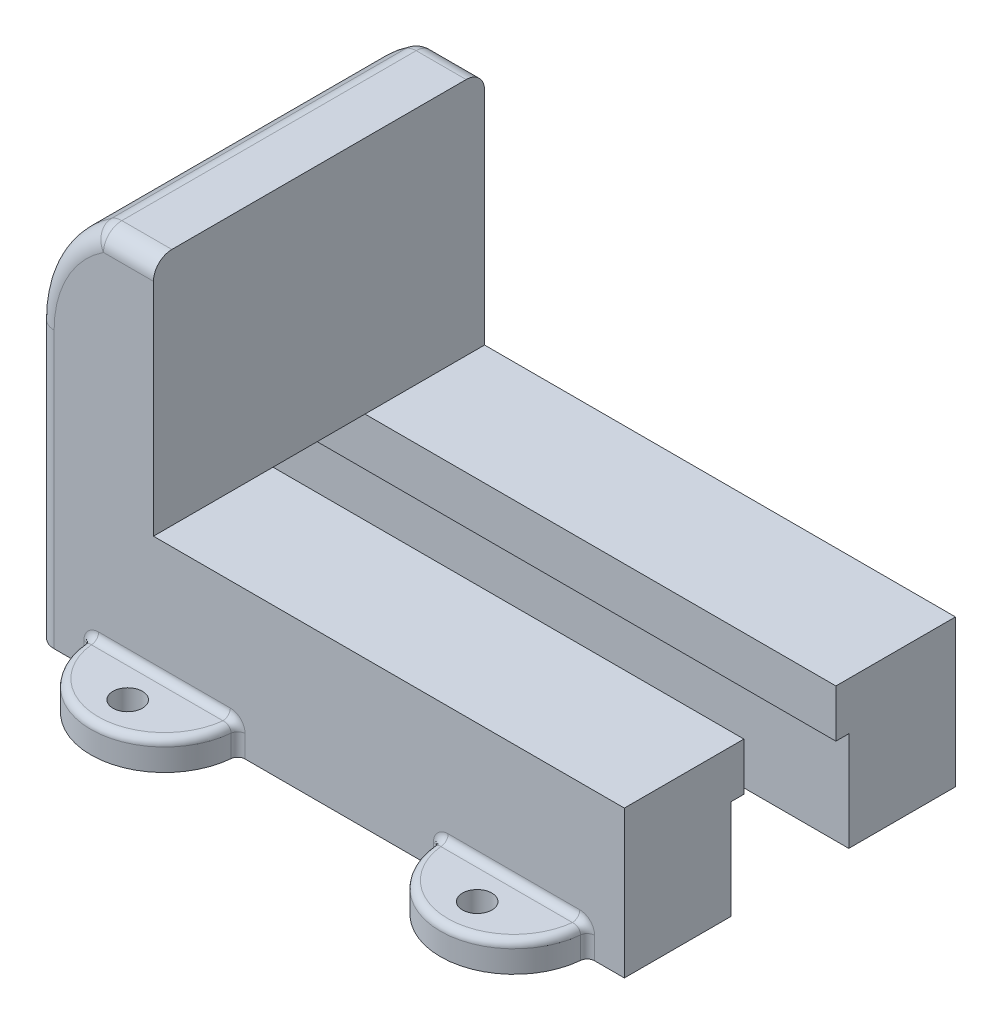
SolidWorks part; units mm, degrees
ref_plane "Front Plane" through (0, 0, 0) normal (0, 0, 1) x (1, 0, 0)
ref_plane "Top Plane" through (0, 0, 0) normal (0, 1, 0) x (1, 0, 0)
ref_plane "Right Plane" through (0, 0, 0) normal (1, 0, 0) x (0, 0, -1)
sketch "Sketch1" plane through (0, 0, 0) normal (0, 0, 1) x (1, 0, 0)
  line L1 (0, 0) -> (185, 0)
  line L2 (0, 0) -> (0, 40)
  line L3 (0, 40) -> (185, 40)
  line L4 (185, 0) -> (185, 40)
  dimension "D1" = 40
  dimension "D2" = 185
extrude "Extrude1" add sketch "Sketch1" along normal mid plane 90
sketch "Sketch2" plane through (0, 0, 45) normal (0, 0, 1) x (1, 0, 0)
  line L1 (0, 40) -> (32, 40)
  line L2 (0, 40) -> (0, 75)
  line L3 (16.9722, 105) -> (32, 105)
  line L4 (32, 40) -> (32, 105)
  arc A0 (0, 75) -> (16.9722, 105) centre (35, 75) cw
  dimension "D2" = 35
  dimension "D1" = 32
  dimension "D3" = 65
  dimension "D4" = 30
extrude "Extrude2" add sketch "Sketch2" against normal up to vertex (90 mm away)
sketch "Sketch3" plane through (185, 0, 0) normal (1, 0, 0) x (0, 0, -1)
  line L0 (-45, 0) -> (-45, 40) construction
  line L1 (-45, 40) -> (45, 40)
  line L2 (-45, 40) -> (-45, 55)
  line L3 (-45, 55) -> (-17, 55)
  line L4 (45, 40) -> (45, 55)
  line L5 (-45, 40) -> (45, 40) construction
  line L6 (-45, 0) -> (45, 0) construction
  line L7 (17, 55) -> (45, 55)
  line L8 (0, 50) -> (0, -50) construction
  arc A0 (17, 55) -> (-17, 55) centre (0, 55) ccw
  dimension "D2" = 17
  dimension "D1" = 55
extrude "Extrude3" add sketch "Sketch3" against normal blind 25
sketch "Sketch4" plane through (185, 0, 0) normal (1, 0, 0) x (0, 0, -1)
  line L0 (-45, 0) -> (45, 0) construction
  line L1 (-16, 0) -> (16, 0)
  line L2 (-12.5, 27) -> (-12.5, 40)
  line L3 (-12.5, 40) -> (12.5, 40)
  line L4 (12.5, 27) -> (12.5, 40)
  line L5 (-16, 0) -> (-16, 27)
  line L6 (-16, 27) -> (-12.5, 27)
  line L7 (16, 27) -> (16, 0)
  line L8 (0, 0) -> (0, 40) construction
  line L9 (12.5, 27) -> (16, 27)
  dimension "D1" = 40
  dimension "D2" = 25
  dimension "D3" = 32
  dimension "D4" = 27
extrude "Cut-Extrude1" cut sketch "Sketch4" against normal through all
sketch "Sketch5" plane through (0, 0, 0) normal (0, -1, 0) x (1, 0, 0)
  line L0 (0, 45) -> (185, 45) construction
  line L1 (15, 45) -> (55, 45)
  arc A0 (15, 45) -> (55, 45) centre (35, 45) cw
  dimension "D1" = 20
  dimension "D2" = 35
extrude "Extrude4" add sketch "Sketch5" against normal blind 8
sketch "Sketch6" plane through (0, 0, 0) normal (0, -1, 0) x (1, 0, 0)
  line L0 (55, 45) -> (185, 45) construction
  line L1 (110, 45) -> (150, 45)
  line L3 (185, 45) -> (185, 16) construction
  arc A0 (110, 45) -> (150, 45) centre (130, 45) cw
  dimension "D1" = 20
  dimension "D2" = 55
extrude "Extrude5" add sketch "Sketch6" against normal up to surface (8 mm away)
mirror "Mirror1" about plane through (0, 0, 0) normal (0, 0, 1) of "Extrude5", "Extrude4"
hole_wizard "Ø8.0 (8) Diameter Hole1" positions "Sketch11" profile "Sketch10" hole size "Ø8.0" standard "Ansi Metric"
sketch "Sketch11" plane through (0, 8, 0) normal (0, 1, 0) x (-1, 0, 0)
  line L0 (0, 0) -> (-84.8783, 0) construction
  line L2 (-35, 55) -> (-35, 45) construction
  line L3 (-130, 55) -> (-130, 45) construction
  line L11 (-15, 45) -> (-55, 45) construction
  point P0 (-35, 55)
  point P1 (-130, 55)
  point P35 (-35, -55)
  point P36 (-130, -55)
  dimension "D1" = 10
sketch "Sketch10" plane through (35, 8, 55) normal (1, 0, 0) x (0, 0, 1)
  line L0 (0, 0) -> (0, 8)
  line L1 (0, 8) -> (4, 8)
  line L2 (4, 8) -> (4, 0)
  line L5 (4, 0) -> (0, 0)
  line L11 (0, -6.35) -> (0, 107.95) construction
  dimension "Thru Hole Dia." = 8
  dimension "Thru Hole Depth" = 8
hole_wizard "Ø14.0 (14) Diameter Hole1" positions "Sketch8" profile "Sketch9" hole size "Ø14.0" standard "Ansi Metric"
sketch "Sketch8" plane through (185, 0, 0) normal (1, 0, 0) x (0, 0, -1)
  point P0 (0, 55)
sketch "Sketch9" plane through (185, 55, 0) normal (0, 1, 0) x (0, 0, -1)
  line L0 (0, 0) -> (0, 25)
  line L1 (0, 25) -> (7, 25)
  line L2 (7, 25) -> (7, 0)
  line L5 (7, 0) -> (0, 0)
  line L11 (0, -6.35) -> (0, 107.95) construction
  dimension "Thru Hole Dia." = 14
  dimension "Thru Hole Depth" = 25
fillet "Fillet1" radius 2 4 edges at (130, 8, -65) (35, 8, -65) (130, 8, 65) (35, 8, 65)
fillet "Fillet2" radius 2 24 edges at (15, 3, -45) (55, 3, -45) (54.4142, 7.4142, -45) (15.5858, 7.4142, -45) (110, 3, -45) (150, 3, -45) (149.4142, 7.4142, -45) (110.5858, 7.4142, -45) (150, 3, 45) (110, 3, 45) (149.4142, 7.4142, 45) (110.5858, 7.4142, 45) (55, 3, 45) (15, 3, 45) (54.4142, 7.4142, 45) (15.5858, 7.4142, 45) (172.5, 55, 45) (172.5, 55, -45) (172.5, 55, -17) (172.5, 55, 17) (35, 8, -45) (130, 8, -45) (130, 8, 45) (35, 8, 45)
fillet "Fillet3" radius 2 9 edges at (185, 26.5, -45) (185, 54.4142, -44.4142) (185, 55, -30.9472) (185, 55.5132, -17.5567) (185, 72, 0) (185, 55.5132, 17.5567) (185, 26.5, 45) (185, 54.4142, 44.4142) (185, 55, 30.9472)
fillet "Fillet10" radius 5 7 edges at (4.5371, 92.2341, 45) (4.5371, 92.2341, -45) (0, 37.5, 45) (0, 37.5, -45) (24.4861, 105, 45) (24.4861, 105, -45) (16.9722, 105, 0)
sketch "Sketch12" plane through (0, 0, 45) normal (0, 0, 1) x (1, 0, 0)
  line L0 (160, 86.7771) -> (160, -16.6768)
extrude "Cut-Extrude2" cut sketch "Sketch12" against normal through all and the other way through all
